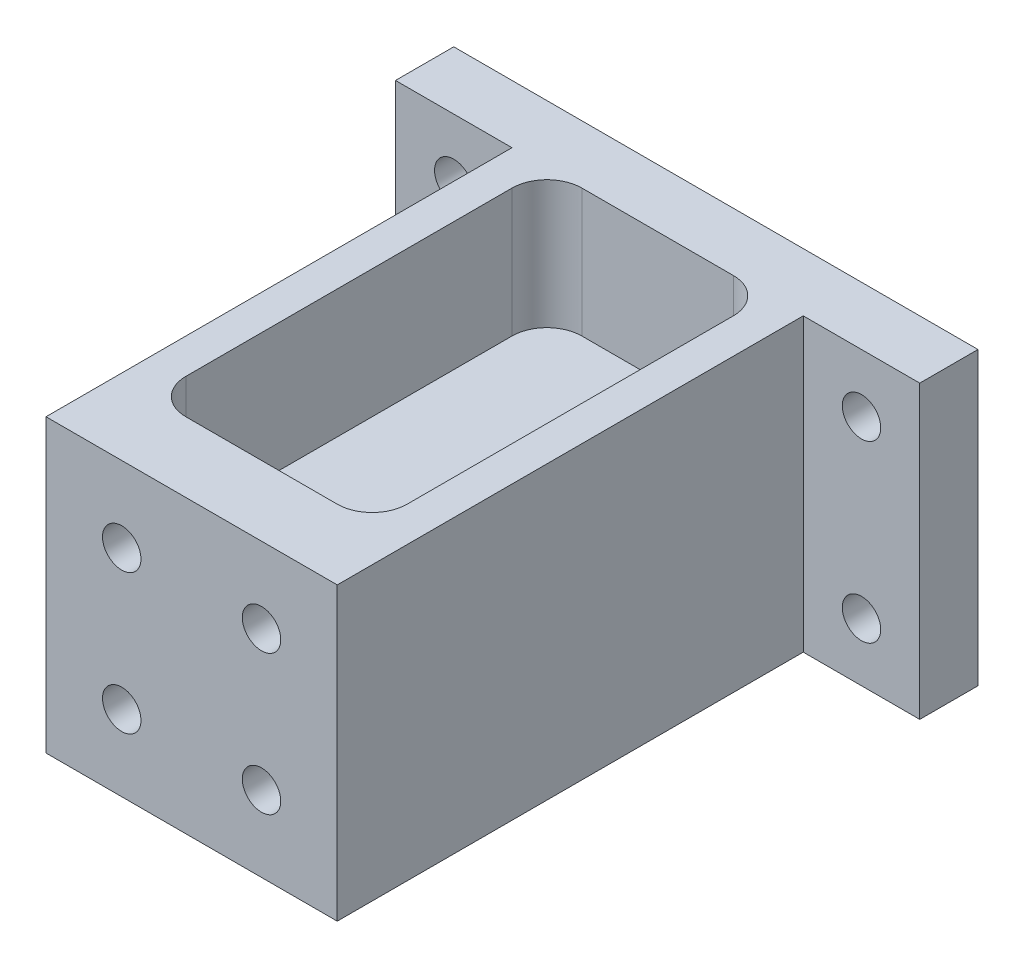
SolidWorks part; units mm, degrees
ref_plane "前视基准面" through (0, 0, 0) normal (0, 0, 1) x (1, 0, 0)
ref_plane "上视基准面" through (0, 0, 0) normal (0, 1, 0) x (1, 0, 0)
ref_plane "右视基准面" through (0, 0, 0) normal (1, 0, 0) x (0, 0, -1)
sketch "草图1" plane through (0, 0, 0) normal (0, 0, 1) x (1, 0, 0)
  line L0 (0, 0) -> (0, 12.5) construction
  line L1 (-12.5, -12.5) -> (12.5, -12.5)
  line L2 (-12.5, -12.5) -> (-12.5, 12.5)
  line L3 (-12.5, 12.5) -> (12.5, 12.5)
  line L4 (12.5, -12.5) -> (12.5, 12.5)
  line L5 (-12.5, -12.5) -> (12.5, 12.5) construction
  line L6 (-12.5, 12.5) -> (12.5, -12.5) construction
  line L7 (0, 0) -> (9.3256, 0) construction
  point P0 (0, 0)
  dimension "D1" = 25
  dimension "D2" = 25
extrude "凸台-拉伸1" add sketch "草图1" along normal blind 45
sketch "草图2" plane through (0, 0, 0) normal (0, 0, -1) x (-1, 0, 0)
  line L0 (0, 0) -> (22.5, 0) construction
  line L1 (-22.5, -12.5) -> (22.5, -12.5)
  line L2 (-22.5, -12.5) -> (-22.5, 12.5)
  line L3 (-22.5, 12.5) -> (22.5, 12.5)
  line L4 (22.5, -12.5) -> (22.5, 12.5)
  line L5 (-22.5, -12.5) -> (22.5, 12.5) construction
  line L6 (-22.5, 12.5) -> (22.5, -12.5) construction
  line L7 (0, 0) -> (0, 12.5) construction
  circle A0 centre (17.5, 7.5) radius 1
  circle A1 centre (-17.5, 7.5) radius 1
  circle A2 centre (-17.5, -7.5) radius 1
  circle A3 centre (17.5, -7.5) radius 1
  point P0 (0, 0)
  dimension "D3" = 2
  dimension "D4" = 15
  dimension "D5" = 35
  dimension "D6" = 2
  dimension "D1" = 25
  dimension "D2" = 45
  dimension "D7" = 2
extrude "凸台-拉伸2" add sketch "草图2" against normal blind 5
sketch "草图3" plane through (0, 0, 45) normal (0, 0, 1) x (1, 0, 0)
  line L0 (0, 0) -> (12.5, 0) construction
  line L1 (12.5, -12.5) -> (12.5, 12.5) construction
  line L2 (0, 0) -> (0, 12.5) construction
  line L3 (12.5, 12.5) -> (-12.5, 12.5) construction
  point P10 (-6, 6)
  point P11 (6, 6)
  point P12 (-6, -6)
  point P13 (6, -6)
  dimension "D1" = 12
  dimension "D2" = 12
  dimension "D3" = 2
  dimension "D4" = 2
hole_wizard "M4 螺纹孔1" positions "3D草图1" profile "草图5" tap size "M4" standard "GB"
sketch3d "3D草图1"
  line L0 (-17.5, 7.5, 5) -> (-17.5, 7.5, 0) construction
  line L1 (-17.5, -7.5, 5) -> (-17.5, -7.5, 0) construction
  line L2 (17.5, -7.5, 5) -> (17.5, -7.5, 0) construction
  line L3 (17.5, 7.5, 5) -> (17.5, 7.5, 0) construction
  point P0 (-6, 6, 45)
  point P3 (6, 6, 45)
  point P6 (6, -6, 45)
  point P9 (-6, -6, 45)
  point P13 (-17.5, 7.5, 5)
  point P17 (-17.5, -7.5, 5)
  point P21 (17.5, -7.5, 5)
  point P25 (17.5, 7.5, 5)
sketch "草图5" plane through (-6, 6, 45) normal (1, 0, 0) x (0, -1, 0)
  line L0 (0, 0) -> (0, 10.9914)
  line L1 (0, 10.9914) -> (1.65, 10)
  line L2 (1.65, 10) -> (1.65, 0)
  line L5 (1.65, 0) -> (0, 0)
  line L10 (0, 10.9914) -> (-1.65, 10) construction
  line L11 (0, -6.35) -> (0, 107.95) construction
  dimension "螺纹孔钻头直径" = 3.3
  dimension "螺纹孔钻头深度" = 10
  dimension "导头角度" = 118
sketch "草图6" plane through (0, -12.5, 0) normal (0, -1, 0) x (1, 0, 0)
  line L0 (0, 45) -> (0, 0) construction
  line L1 (-12.5, 45) -> (12.5, 45) construction
  line L2 (12.5, 45) -> (12.5, 5) construction
  line L3 (2.25, 39) -> (9.5, 39)
  line L5 (2.25, 5) -> (9.5, 5)
  line L6 (9.5, 39) -> (9.5, 5)
  line L7 (22.5, 5) -> (12.5, 5) construction
  line L8 (0, 45) -> (12.5, 45) construction
  line L9 (-9.5, 39) -> (-9.5, 5)
  line L10 (-2.25, 5) -> (-9.5, 5)
  line L12 (-2.25, 39) -> (-9.5, 39)
  line L14 (-2.25, 39) -> (2.25, 39)
  line L16 (-2.25, 5) -> (2.25, 5)
  dimension "D2" = 3
  dimension "D3" = 0
  dimension "D4" = 6
extrude "切除-拉伸1" cut sketch "草图6" against normal blind 11
mirror "镜向1" about plane through (0, 0, 0) normal (0, 1, 0) of "切除-拉伸1"
fillet "圆角1" radius 3 8 edges at (9.5, 7, 5) (-9.5, 7, 5) (-9.5, 7, 39) (9.5, 7, 39) (9.5, -7, 5) (-9.5, -7, 5) (9.5, -7, 39) (-9.5, -7, 39)
